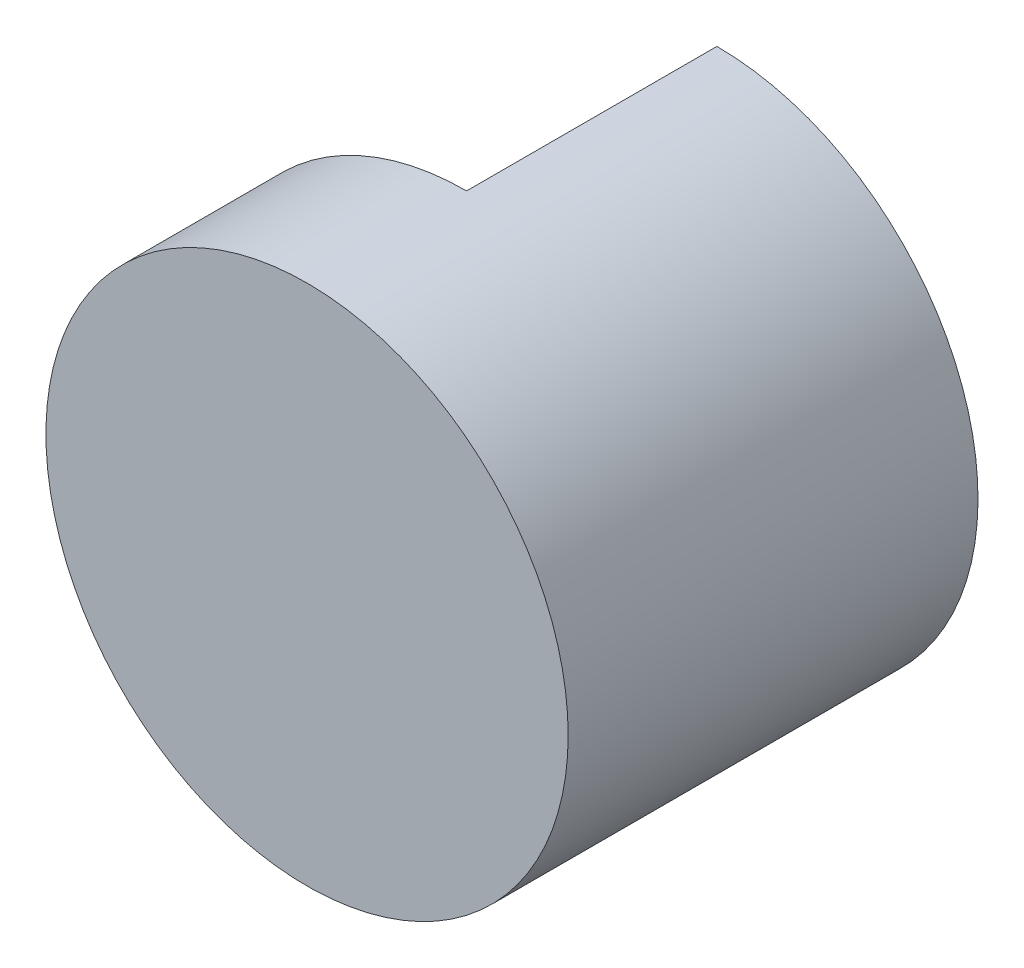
SolidWorks part; units mm, degrees
ref_plane "Přední rovina" through (0, 0, 0) normal (0, 0, 1) x (1, 0, 0)
ref_plane "Horní rovina" through (0, 0, 0) normal (0, 1, 0) x (1, 0, 0)
ref_plane "Pravá rovina" through (0, 0, 0) normal (1, 0, 0) x (0, 0, -1)
sketch "Skica1" plane through (0, 0, 0) normal (0, 0, 1) x (1, 0, 0)
  circle A0 centre (0, 0) radius 23.893
  dimension "D1" = 47.786
extrude "Přidat vysunutím2" add sketch "Skica1" along normal blind 23.5
sketch "Skica7" plane through (0, 0, 23.5) normal (0, 0, 1) x (1, 0, 0)
  circle A0 centre (0, 0) radius 23.893
  dimension "D1" = 47.786
extrude "Přidat vysunutím3" add sketch "Skica7" along normal blind 14
sketch "Skica8" plane through (0, 0, 37.5) normal (0, 0, 1) x (1, 0, 0)
  circle A0 centre (0, 0) radius 15
  dimension "D1" = 30
extrude "Přidat vysunutím4" add sketch "Skica8" along normal blind 40
sketch "Skica9" plane through (0, 0, 0) normal (0, 1, 0) x (1, 0, 0)
  line L0 (0, 0) -> (0, -15)
  line L1 (23.893, 0) -> (-23.893, 0) construction
  line L2 (0, 0) -> (20, 0)
  line L3 (0, -15) -> (20, 0)
  line L4 (0, -53.9245) -> (0, 1.9891) construction
  dimension "D1" = 15
  dimension "D2" = 20
revolve "Odebrat rotací1" cut sketch "Skica9" angle 360 about L4
scale "Měřítko1" scale about origin uniform scaling yes scale factor 0.655
sketch "Skica10" plane through (0, 0, 0) normal (0, 0, -1) x (-1, 0, 0)
  line L0 (0, 0) -> (0, 30.2592)
  line L1 (0, 0) -> (26.9611, -13.7374)
  circle A0 centre (0, 0) radius 30.2592
  dimension "D2" = 60.5184
  dimension "D1" = 117
extrude "Odebrat vysunutím1" cut sketch "Skica10" against normal blind 15 contours L0 L1 M3 | L1 L0 M3 M4 | L1 A0 L0 M4
sketch "Skica11" plane through (0, 0, 24.5625) normal (0, 0, 1) x (1, 0, 0)
  circle A0 centre (0, 0) radius 75.9743
extrude "Odebrat vysunutím2" cut sketch "Skica11" along normal through all
